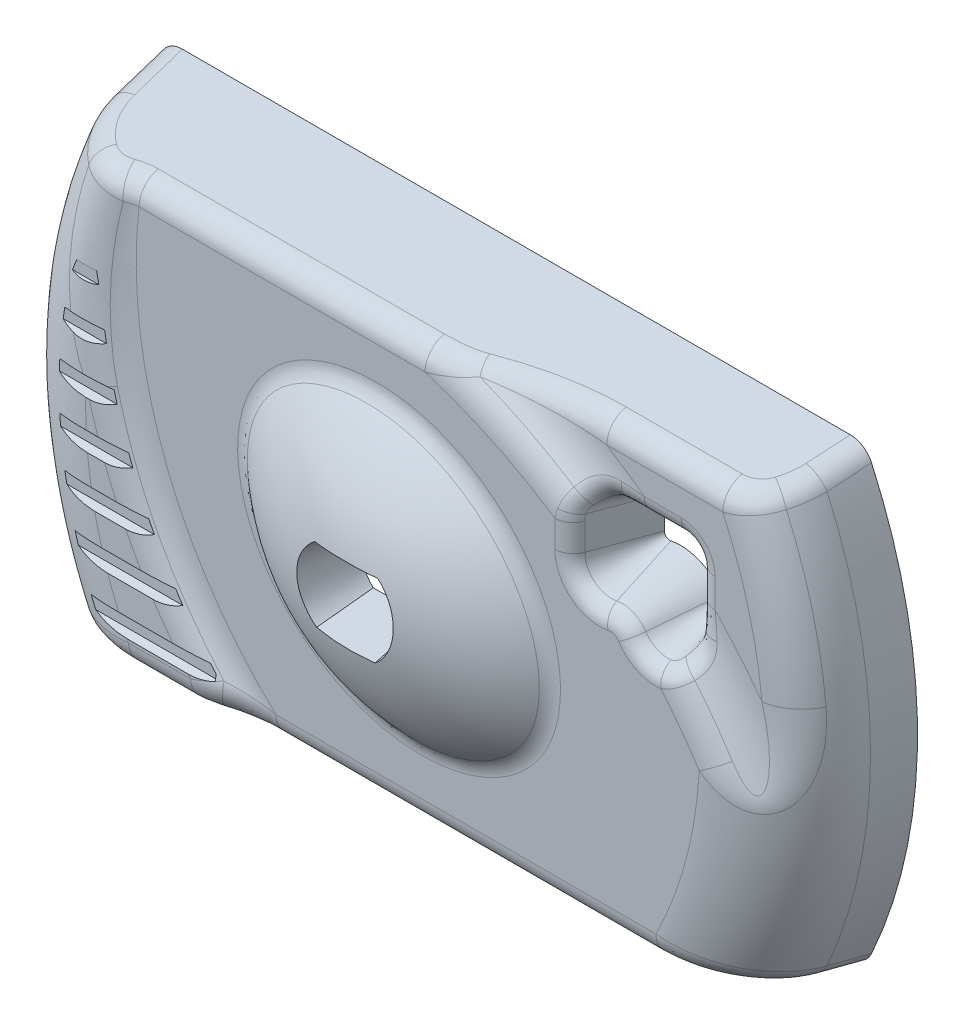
SolidWorks part; units mm, degrees
ref_plane "Front Plane" through (0, 0, 0) normal (0, 0, 1) x (1, 0, 0)
ref_plane "Top Plane" through (0, 0, 0) normal (0, 1, 0) x (1, 0, 0)
ref_plane "Right Plane" through (0, 0, 0) normal (1, 0, 0) x (0, 0, -1)
imported_body "Imported1"
imported_body "Imported2"
other "Intersect1"
